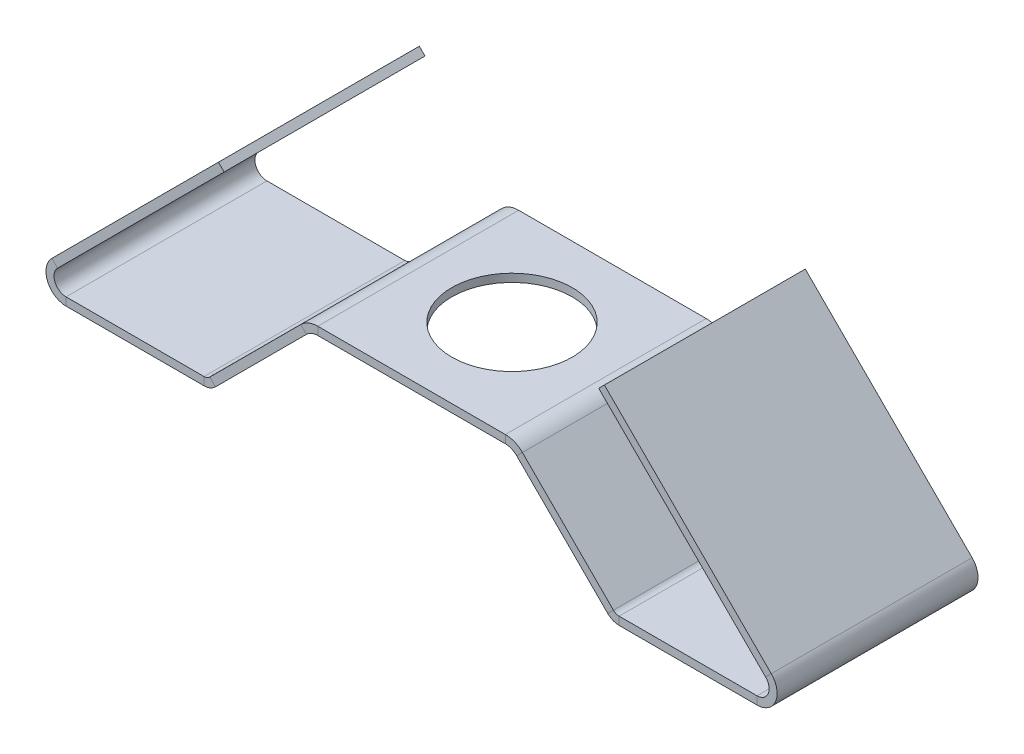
SolidWorks part; units mm, degrees
ref_plane "Front Plane" through (0, 0, 0) normal (0, 0, 1) x (1, 0, 0)
ref_plane "Top Plane" through (0, 0, 0) normal (0, 1, 0) x (1, 0, 0)
ref_plane "Right Plane" through (0, 0, 0) normal (1, 0, 0) x (0, 0, -1)
sketch "Sketch9" plane through (0, 0, 0) normal (0, 0, 1) x (1, 0, 0)
  line L0 (-4.8071, 5) -> (-8.9536, 0.8536)
  line L1 (-8.6, 0) -> (-5.1657, 0)
  line L2 (8.9533, 0.8539) -> (4.8, 5)
  line L3 (-4.8828, 0.1172) -> (-2.6172, 2.3828)
  line L4 (-2.3343, 2.5) -> (2.3343, 2.5)
  line L5 (2.6172, 2.3828) -> (4.8828, 0.1172)
  line L6 (4.8, 5) -> (-4.8071, 5) construction
  line L7 (5.1657, 0) -> (8.6, 0)
  line L8 (0, 0) -> (0, 2.5) construction
  line L9 (-8.6, 0.5) -> (-9.1, 0.5) construction
  line L10 (8.6, 0.5) -> (9.1, 0.5) construction
  line L11 (8.6, 0.5) -> (-8.6, 0.5) construction
  line L12 (8.6, 0) -> (8.6, 0.5) construction
  arc A0 (-8.9536, 0.8536) -> (-8.6, 0) centre (-8.6, 0.5) ccw
  arc A1 (8.6, 0) -> (8.9533, 0.8539) centre (8.6, 0.5) ccw
  arc A2 (-2.6172, 2.3828) -> (-2.3343, 2.5) centre (-2.3343, 2.1) cw
  arc A3 (2.3343, 2.5) -> (2.6172, 2.3828) centre (2.3343, 2.1) cw
  arc A4 (4.8828, 0.1172) -> (5.1657, 0) centre (5.1657, 0.4) ccw
  arc A5 (-5.1657, 0) -> (-4.8828, 0.1172) centre (-5.1657, 0.4) ccw
  point P18 (-2.5, 2.5)
  point P23 (2.5, 2.5)
  point P26 (5, 0)
  point P29 (-5, 0)
  dimension "D7" = 0.5
  dimension "D8" = 0.5
  dimension "D9" = 0.4
  dimension "D1" = 5
  dimension "D2" = 10
  dimension "D3" = 45
  dimension "D4" = 5
  dimension "D5" = 18.2
  dimension "D6" = 4.3
ref_plane "sketch plane" through (-4.8071, 5, 0) normal (-0.7071, -0.7071, 0) x (-0.7071, 0.7071, 0)
sketch "Sketch10" plane through (-4.8071, 5, 0) normal (-0.7071, -0.7071, 0) x (-0.7071, 0.7071, 0)
  line L1 (0, 2.5) -> (-0.2, 2.5)
  line L2 (0, 2.5) -> (0, -2.5)
  line L3 (0, -2.5) -> (-0.2, -2.5)
  line L4 (-0.2, 2.5) -> (-0.2, -2.5)
  dimension "D1" = 5
  dimension "D2" = 0.2
sweep "Sweep3" add profiles "Sketch10" path "Sketch9"
sketch "Sketch11" plane through (0, 2.7, 0) normal (0, 1, 0) x (1, 0, 0)
  circle A0 centre (0, 0) radius 1.5
  dimension "D1" = 3
extrude "hole" cut sketch "Sketch11" against normal through all
